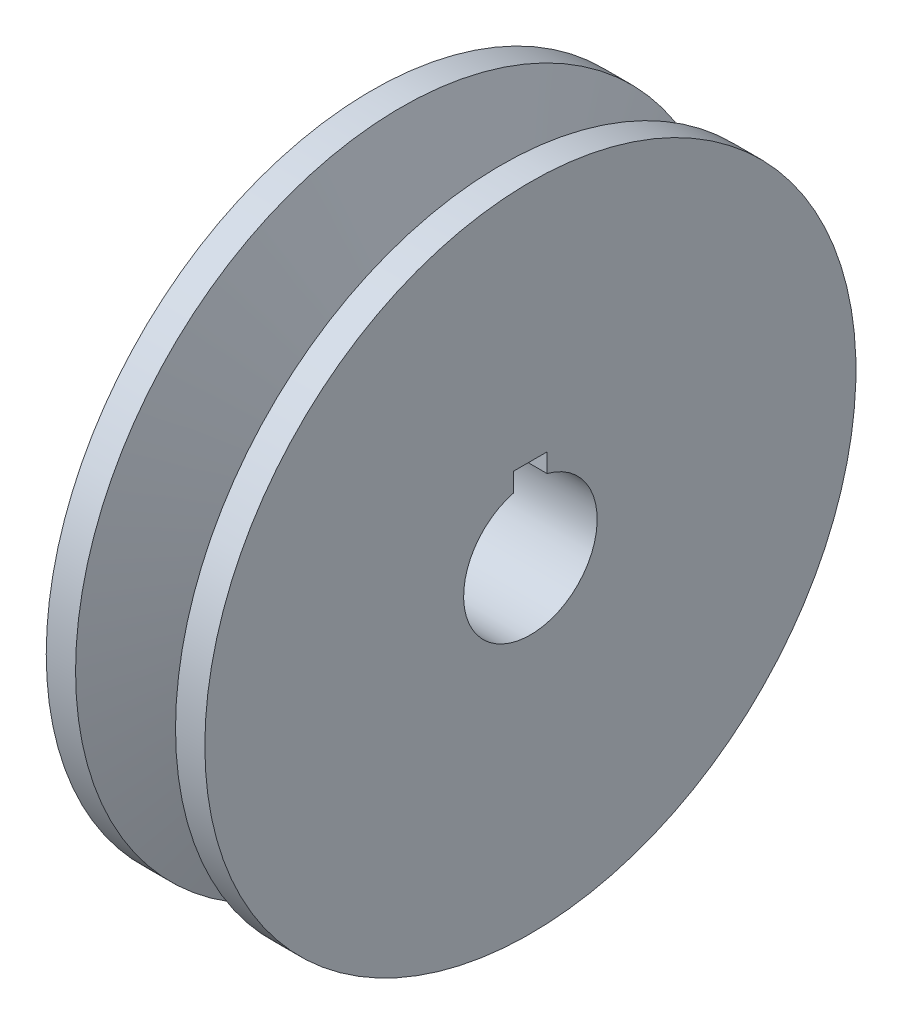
SolidWorks part; units mm, degrees
ref_plane "Plan1" through (0, 0, 0) normal (0, 0, 1) x (1, 0, 0)
ref_plane "Plan2" through (0, 0, 0) normal (0, 1, 0) x (1, 0, 0)
ref_plane "Plan3" through (0, 0, 0) normal (1, 0, 0) x (0, 0, -1)
sketch "Esquisse1" plane through (0, 0, 0) normal (0, 0, 1) x (1, 0, 0)
  line L0 (0, 0) -> (19, 0)
  line L1 (19, 0) -> (19, 39)
  line L2 (11.4259, 26.5) -> (15.4874, 39)
  line L3 (11.4259, 26.5) -> (7.5741, 26.5)
  line L4 (15.4874, 39) -> (19, 39)
  line L5 (0, 39) -> (0, 0)
  line L6 (4, 37.5) -> (15, 37.5) construction
  line L7 (7.5741, 26.5) -> (3.5126, 39)
  line L8 (3.5126, 39) -> (0, 39)
  line L9 (19, 0) -> (32.7316, 0) construction
  dimension "D1" = 19
  dimension "D2" = 39
  dimension "D3" = 37.5
  dimension "D4" = 11
  dimension "D5" = 26.5
  dimension "D6" = 36
  dimension "D7" = 18
revolve "Révolution1" add sketch "Esquisse1" angle 360 about L9
sketch "Esquisse2" plane through (19, 0, 0) normal (1, 0, 0) x (0, 0, -1)
  line L0 (-2, 10) -> (2, 10)
  line L1 (-2, 10) -> (-2, 7.746)
  line L2 (2, 10) -> (2, 7.746)
  arc A0 (-2, 7.746) -> (2, 7.746) centre (0, 0) ccw
  dimension "D1" = 16
  dimension "D2" = 10
  dimension "D3" = 4
  dimension "D4" = 2
extrude "Enlèv. mat.-Extru.1" cut sketch "Esquisse2" against normal through all
